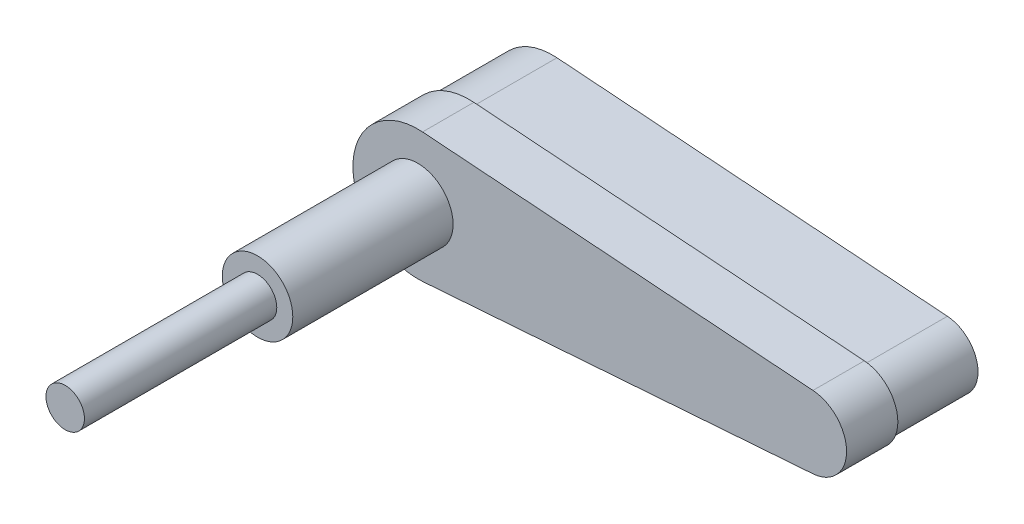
SolidWorks part; units mm, degrees
ref_plane "Plan de face" through (0, 0, 0) normal (0, 0, 1) x (1, 0, 0)
ref_plane "Plan de dessus" through (0, 0, 0) normal (0, 1, 0) x (1, 0, 0)
ref_plane "Plan de droite" through (0, 0, 0) normal (1, 0, 0) x (0, 0, -1)
sketch "Esquisse1" plane through (0, 0, 0) normal (0, 0, 1) x (1, 0, 0)
  line L0 (0, 0) -> (76, 0) construction
  line L1 (10.3295, 9.6) -> (71.227, 5.1357)
  line L2 (10.3295, -9.6) -> (71.227, -5.1357)
  arc A0 (10.3295, 9.6) -> (10.3295, -9.6) centre (9.6258, 0) ccw
  arc A1 (71.227, 5.1357) -> (71.227, -5.1357) centre (70.8505, 0) cw
  dimension "D1" = 9.6
  dimension "D3" = 5.1357
extrude "Boss.-Extru.1" add sketch "Esquisse1" along normal blind 13
sketch "Esquisse3" plane through (0, 0, 13) normal (0, 0, 1) x (1, 0, 0)
  line L4 (71.2636, 5.6344) -> (10.3661, 10.0987)
  line L5 (10.3661, -10.0987) -> (71.2636, -5.6344)
  arc A0 (10.3295, 9.6) -> (10.3295, -9.6) centre (9.6258, 0) ccw construction
  arc A4 (10.3661, 10.0987) -> (10.3661, -10.0987) centre (9.6258, 0) ccw
  arc A5 (71.2636, -5.6344) -> (71.2636, 5.6344) centre (70.8505, 0) ccw
  point P3 (0, 0)
  dimension "D1" = 20.1973
  dimension "D2" = 11.2687
  dimension "D3" = 61.2248
  dimension "D4" = 9.6258
  dimension "D5" = 5.6344
extrude "Boss.-Extru.2" add sketch "Esquisse3" along normal blind 8
sketch "Esquisse4" plane through (0, 0, 21) normal (0, 0, 1) x (1, 0, 0)
  circle A0 centre (9.6258, 0) radius 5.5
  arc A1 (10.3661, 10.0987) -> (10.3661, -10.0987) centre (9.6258, 0) ccw construction
  dimension "D1" = 11
extrude "Boss.-Extru.3" add sketch "Esquisse4" along normal blind 55
sketch "Esquisse5" plane through (0, 0, 76) normal (0, 0, 1) x (1, 0, 0)
  circle A0 centre (9.6258, 0) radius 3
  circle A1 centre (9.6258, 0) radius 5.5 construction
  circle A2 centre (9.6258, 0) radius 5.5
  dimension "D1" = 6
extrude "Enlèv. mat.-Extru.1" cut sketch "Esquisse5" against normal blind 30
